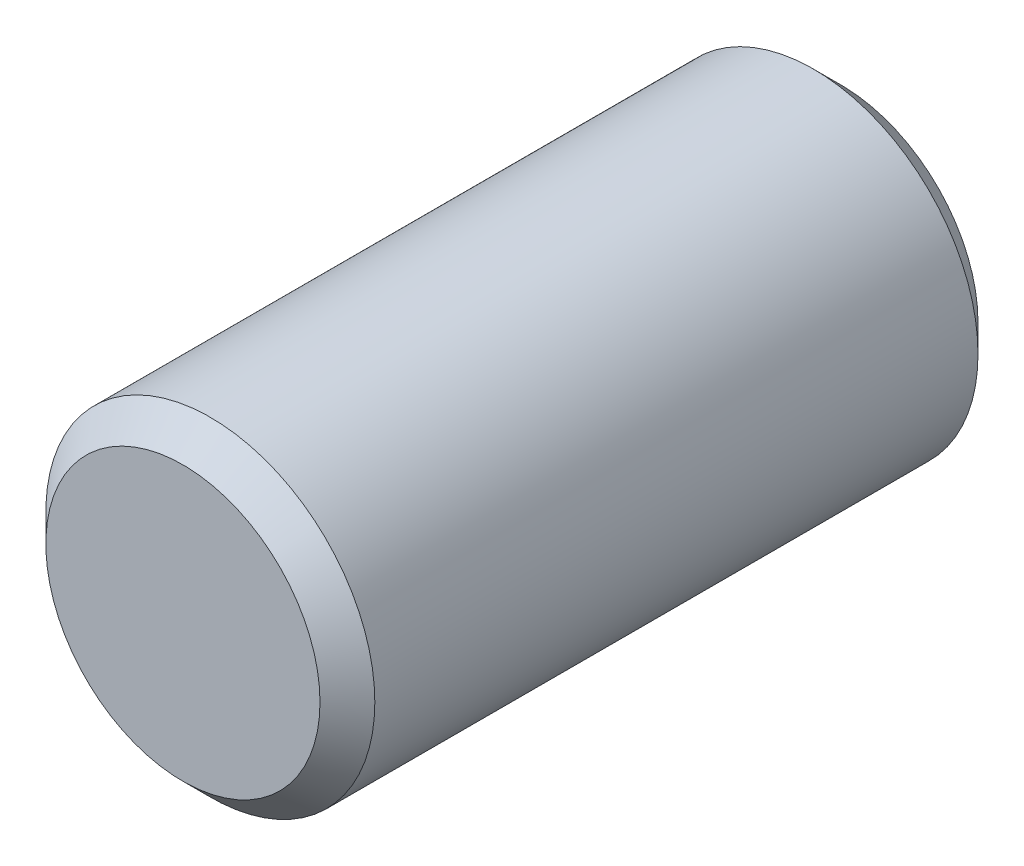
SolidWorks part; units mm, degrees
ref_plane "Front Plane" through (0, 0, 0) normal (0, 0, 1) x (1, 0, 0)
ref_plane "Top Plane" through (0, 0, 0) normal (0, 1, 0) x (1, 0, 0)
ref_plane "Right Plane" through (0, 0, 0) normal (1, 0, 0) x (0, 0, -1)
sketch "Sketch1" plane through (0, 0, 0) normal (1, 0, 0) x (0, 0, -1)
  line L0 (10.6747, 0) -> (50010.6747, 0) construction
  line L1 (0, 0) -> (6, 0)
  line L6 (0.25, 1.5) -> (0, 1.25)
  line L7 (0, 1.25) -> (0, 0)
  line L8 (5.75, 1.5) -> (0.25, 1.5)
  line L9 (6, 1.25) -> (5.75, 1.5)
  line L10 (6, 0) -> (6, 1.25)
  dimension "D1" = 45
  dimension "D2" = 45
  dimension "D3" = 6
  dimension "D4" = 0.25
  dimension "D5" = 3
revolve "Revolve1" add sketch "Sketch1" angle 360 about L0
